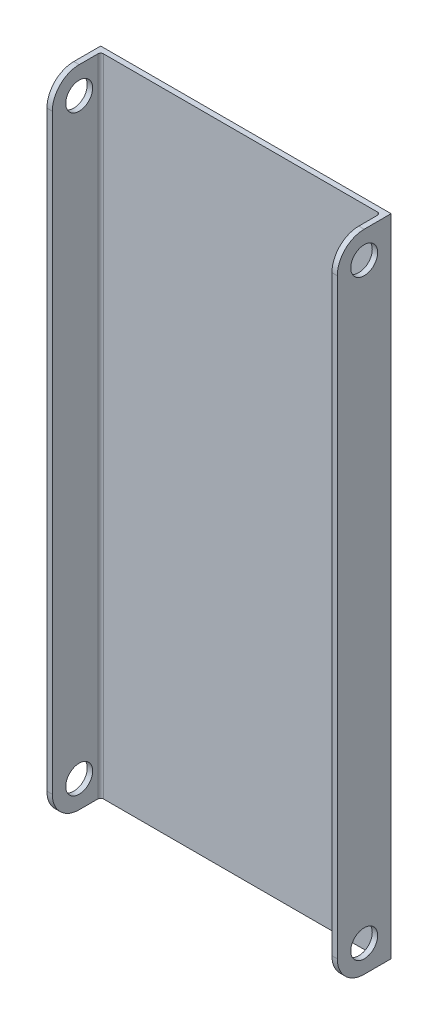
SolidWorks part; units mm, degrees
ref_plane "Front Plane" through (0, 0, 0) normal (0, 0, 1) x (1, 0, 0)
ref_plane "Top Plane" through (0, 0, 0) normal (0, 1, 0) x (1, 0, 0)
ref_plane "Right Plane" through (0, 0, 0) normal (1, 0, 0) x (0, 0, -1)
sketch "Sketch3" plane through (0, 0, 0) normal (0, 0, 1) x (1, 0, 0)
  line L1 (0, 0) -> (-68.58, 0)
  line L2 (0, 0) -> (0, 152.4)
  line L3 (0, 152.4) -> (-68.58, 152.4)
  line L4 (-68.58, 0) -> (-68.58, 152.4)
  dimension "D1" = 152.4
  dimension "D2" = 68.58
extrude "Boss-Extrude1" add sketch "Sketch3" along normal blind 1.27
sketch "Sketch4" plane through (0, 0, 0) normal (1, 0, 0) x (0, 0, -1)
  line L0 (-1.27, 152.4) -> (0, 152.4) construction
  line L1 (0, 0) -> (-12.7, 0)
  line L2 (0, 0) -> (0, 152.4)
  line L3 (0, 152.4) -> (-12.7, 152.4)
  line L4 (-12.7, 0) -> (-12.7, 152.4)
  circle A0 centre (-6.35, 6.35) radius 3.175
  circle A1 centre (-6.35, 146.05) radius 3.175
  dimension "D2" = 6.35
  dimension "D1" = 12.7
  dimension "D3" = 6.35
  dimension "D4" = 6.35
  dimension "D5" = 6.35
extrude "Boss-Extrude2" add sketch "Sketch4" against normal blind 1.27
ref_plane "Plane1" through (-34.29, 0, 0) normal (1, 0, 0) x (0, 0, -1)
mirror "Mirror3" about plane through (-34.29, 0, 0) normal (1, 0, 0) of "Boss-Extrude2"
fillet "Fillet1" radius 6.35 4 edges at (-67.945, 0, 12.7) (-67.945, 152.4, 12.7) (-0.635, 152.4, 12.7) (-0.635, 0, 12.7)
fillet "Fillet3" radius 0.635 2 edges at (-1.27, 76.2, 1.27) (-67.31, 76.2, 1.27)
equation "\"A\"= 20.50"
equation "\"B\"= 6.50"
equation "\"C\"= 36"
